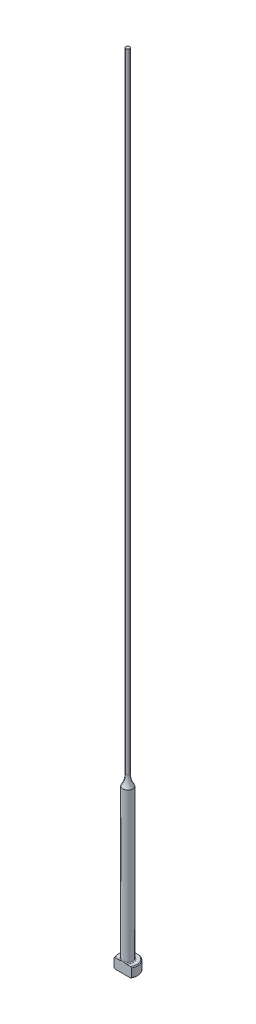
SolidWorks part; units mm, degrees
ref_plane "Front Plane" through (0, 0, 0) normal (0, 0, 1) x (1, 0, 0)
ref_plane "Top Plane" through (0, 0, 0) normal (0, 1, 0) x (1, 0, 0)
ref_plane "Right Plane" through (0, 0, 0) normal (1, 0, 0) x (0, 0, -1)
sketch "Sketch1" plane through (0, 0, 0) normal (0, 0, 1) x (1, 0, 0)
  line L0 (0, 259.9588) -> (0, -15.1925) construction
  line L1 (0, 0) -> (-3.175, 0)
  line L2 (-3.175, 0) -> (-3.175, 3.175)
  line L3 (-3.175, 3.175) -> (-1.5875, 3.175)
  line L4 (-0.5944, 54.2098) -> (-0.5944, 254)
  line L5 (-0.5944, 254) -> (0, 254)
  line L6 (0, 254) -> (0, 0)
  line L7 (-1.5875, 3.175) -> (-1.5875, 50.8)
  arc A0 (-1.5875, 50.8) -> (-0.5944, 54.2098) centre (-6.9444, 54.2098) ccw
  point P13 (-1.5875, 0)
  dimension "D1" = 6.35
  dimension "L" = 254
  dimension "D2" = 3.175
  dimension "H" = 6.35
  dimension "T" = 3.175
  dimension "D" = 1.1887
  dimension "S" = 50.8
revolve "Revolve1" add sketch "Sketch1" angle 360 about L0
chamfer "Chamfer1" distance 0.254 angle 45 2 edges at (0, 3.175, 3.175) (0, 0, 3.175)
fillet "Fillet1" radius 0.254 1 edges at (0, 3.175, 1.5875)
sketch "Sketch2" plane through (0, 0, 0) normal (0, -1, 0) x (1, 0, 0)
  line L0 (-2.7496, 1.5875) -> (2.7496, 1.5875)
  arc A0 (2.7496, 1.5875) -> (-2.7496, 1.5875) centre (0, 0) ccw
  circle A1 centre (0, 0) radius 3.175 construction
  circle A2 centre (0, 0) radius 1.5875 construction
extrude "Cut-Extrude1" cut sketch "Sketch2" against normal through all
